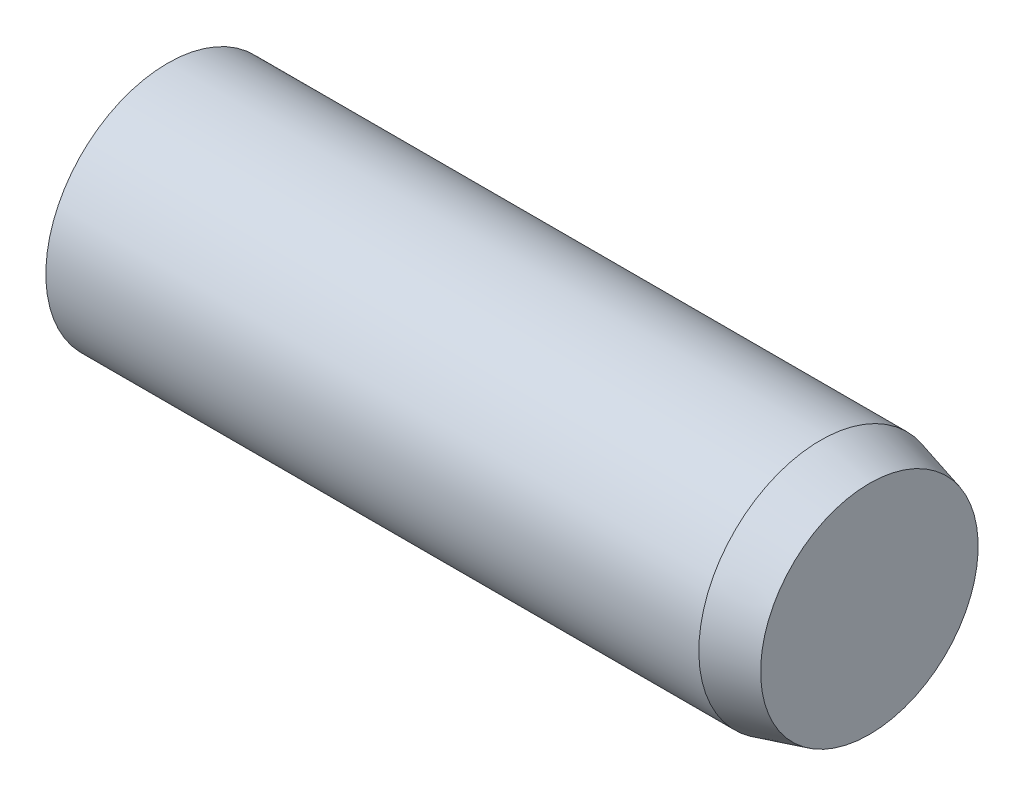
SolidWorks part; units mm, degrees
ref_plane "Plane1" through (0, 0, 0) normal (0, 0, 1) x (1, 0, 0)
ref_plane "Plane2" through (0, 0, 0) normal (0, 1, 0) x (1, 0, 0)
ref_plane "Plane3" through (0, 0, 0) normal (1, 0, 0) x (0, 0, -1)
other "Configuration Table"
sketch "BodySke" plane through (0, 0, 0) normal (0, 0, 1) x (1, 0, 0)
  line L0 (0, 0) -> (40.9091, 0) construction
  line L1 (28, 5) -> (30, 4.4641)
  line L2 (1.2, 5) -> (28, 5)
  line L3 (30, 4.4641) -> (30, 0)
  line L4 (0, 0) -> (30, 0)
  arc A0 (1.2, 5) -> (0, 0) centre (11.0167, 0) ccw
  dimension "D1" = 15
  dimension "Diameter" = 10
  dimension "Length" = 30
  dimension "Crown_ht" = 1.2
  dimension "Chamfer_len" = 2
revolve "Body" add sketch "BodySke" angle 360 about L0
equation "' \"D1@BodySke\" = \"Length@BodySke\""
